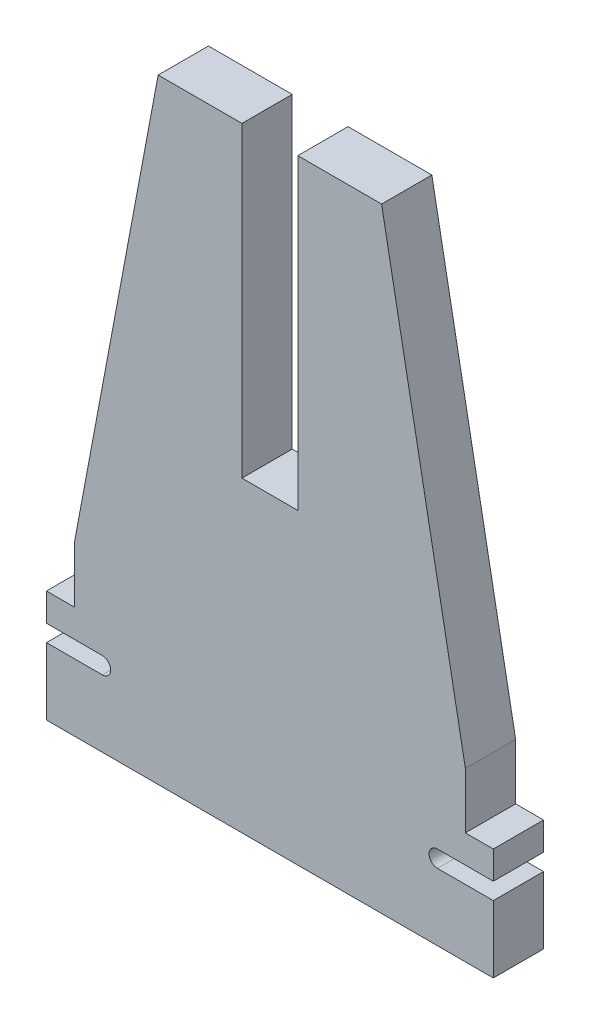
SolidWorks part; units mm, degrees
ref_plane "Plan de face" through (0, 0, 0) normal (0, 0, 1) x (1, 0, 0)
ref_plane "Plan de dessus" through (0, 0, 0) normal (0, 1, 0) x (1, 0, 0)
ref_plane "Plan de droite" through (0, 0, 0) normal (1, 0, 0) x (0, 0, -1)
sketch "Esquisse1" plane through (0, 0, 0) normal (0, 0, 1) x (1, 0, 0)
  line L0 (0, 20) -> (0, 30)
  line L1 (-15, 110) -> (-55, 110)
  line L2 (-55, 110) -> (-70, 30)
  line L3 (-70, 30) -> (-70, 20)
  line L4 (-75, 0) -> (0, 0)
  line L5 (-70, 20) -> (-75, 20)
  line L6 (-75, 20) -> (-75, 0)
  line L7 (-15, 110) -> (0, 30)
  line L8 (0, 30) -> (-70, 30) construction
  line L9 (-35, 110) -> (-35, 0) construction
  line L10 (0, 20) -> (5, 20)
  line L11 (5, 20) -> (5, 0)
  line L12 (5, 0) -> (0, 0)
  dimension "D1" = 10
  dimension "D2" = 110
  dimension "D3" = 75
  dimension "D4" = 5
  dimension "D5" = 40
  dimension "D6" = 80
  dimension "D8" = 5
extrude "Boss.-Extru.1" add sketch "Esquisse1" against normal blind 9
sketch "Esquisse2" plane through (0, 0, 0) normal (0, 0, 1) x (1, 0, 0)
  line L0 (-15, 110) -> (-55, 110) construction
  line L1 (-40, 110) -> (-30, 110)
  line L2 (-40, 110) -> (-40, 55)
  line L3 (-40, 55) -> (-30, 55)
  line L4 (-30, 110) -> (-30, 55)
  dimension "D1" = 10
  dimension "D2" = 15
  dimension "D3" = 55
extrude "Enlèv. mat.-Extru.1" cut sketch "Esquisse2" against normal through all
sketch "Esquisse3" plane through (0, 0, 0) normal (0, 0, 1) x (1, 0, 0)
  line L0 (5, 15) -> (-5, 15)
  line L1 (5, 0) -> (5, 20) construction
  line L2 (5, 15) -> (5, 12)
  line L3 (-5, 12) -> (5, 12)
  line L4 (-35, 0) -> (-35, 55) construction
  line L5 (-75, 0) -> (5, 0) construction
  line L6 (-40, 55) -> (-30, 55) construction
  line L7 (-65, 12) -> (-75, 12)
  line L8 (-75, 15) -> (-75, 12)
  line L9 (-75, 15) -> (-65, 15)
  line L10 (5, 20) -> (0, 20) construction
  arc A0 (-5, 15) -> (-5, 12) centre (-5, 13.5) ccw
  arc A1 (-65, 15) -> (-65, 12) centre (-65, 13.5) cw
  dimension "D1" = 3
  dimension "D2" = 10
  dimension "D3" = 5
extrude "Enlèv. mat.-Extru.2" cut sketch "Esquisse3" against normal blind 10
